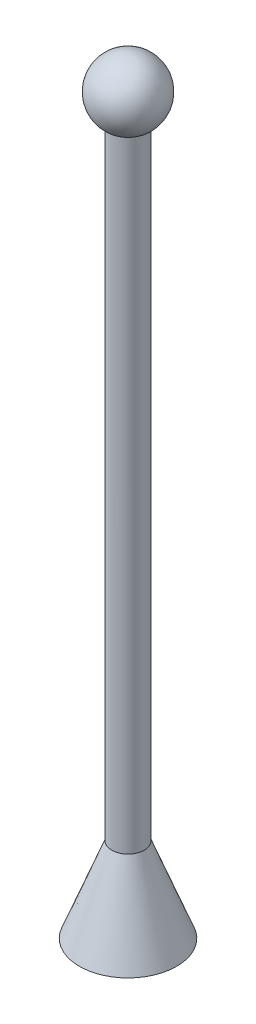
SolidWorks part; units mm, degrees
ref_plane "Front Plane" through (0, 0, 0) normal (0, 0, 1) x (1, 0, 0)
ref_plane "Top Plane" through (0, 0, 0) normal (0, 1, 0) x (1, 0, 0)
ref_plane "Right Plane" through (0, 0, 0) normal (1, 0, 0) x (0, 0, -1)
ref_plane "Plane1" through (0, 33.02, 0) normal (0, 1, 0) x (-1, 0, 0)
sketch "Sketch1" plane through (0, 0, 0) normal (0, 1, 0) x (1, 0, 0)
  circle A0 centre (0, 0) radius 19.05
  dimension "D1" = 38.1
sketch "Sketch2" plane through (0, 33.02, 0) normal (0, 1, 0) x (-1, 0, 0)
  circle A0 centre (0, 0) radius 6.35
  dimension "D1" = 12.7
loft "Loft1" add profiles "Sketch2", "Sketch1"
sketch "Sketch3" plane through (0, 33.02, 0) normal (0, 1, 0) x (1, 0, 0)
  circle A0 centre (0, 0) radius 6.35
  dimension "D1" = 12.7
extrude "Boss-Extrude1" add sketch "Sketch3" along normal blind 254
sketch "Sketch4" plane through (0, 0, 0) normal (0, 0, 1) x (1, 0, 0)
  line L0 (6.35, 287.02) -> (-6.35, 287.02) construction
  line L1 (0, 299.72) -> (0, 274.32)
  arc A0 (0, 299.72) -> (0, 274.32) centre (0, 287.02) ccw
  dimension "D1" = 12.7
ref_axis "Axis1" through (0, 299.72, 0) along (0, -1, 0)
revolve "Revolve1" add sketch "Sketch4" angle 360 about axis through (0, 299.72, 0) along (0, -1, 0)
